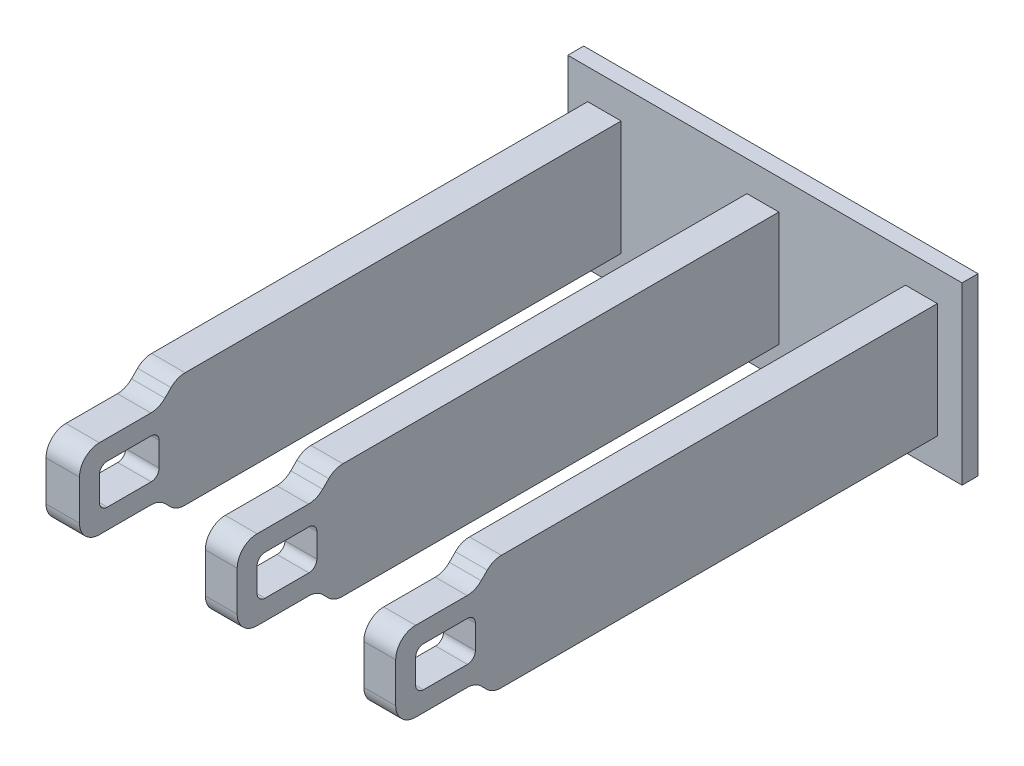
SolidWorks part; units mm, degrees
ref_plane "Plan de face" through (0, 0, 0) normal (0, 0, 1) x (1, 0, 0)
ref_plane "Plan de dessus" through (0, 0, 0) normal (0, 1, 0) x (1, 0, 0)
ref_plane "Plan de droite" through (0, 0, 0) normal (1, 0, 0) x (0, 0, -1)
sketch "Esquisse1" plane through (0, 0, 0) normal (0, 0, 1) x (1, 0, 0)
  line L1 (0, 0) -> (9.9, 0)
  line L2 (0, 0) -> (0, 4.4)
  line L3 (0, 4.4) -> (9.9, 4.4)
  line L4 (9.9, 0) -> (9.9, 4.4)
  dimension "D1" = 4.4
  dimension "D2" = 9.9
extrude "Boss.-Extru.1" add sketch "Esquisse1" along normal blind 14
sketch "Esquisse2" plane through (0, 0, 14) normal (0, 0, 1) x (1, 0, 0)
  line L0 (9.9, 4.4) -> (0, 4.4) construction
  line L1 (0, 0) -> (0.5, 0)
  line L2 (0, 0) -> (0, 4.4)
  line L3 (0, 4.4) -> (0.5, 4.4)
  line L4 (0.5, 0) -> (0.5, 4.4)
  line L5 (0, 0) -> (9.9, 0) construction
  line L6 (1.34, 4.4) -> (4.5, 4.4)
  line L7 (1.34, 4.4) -> (1.34, 0)
  line L8 (1.34, 0) -> (4.5, 0)
  line L9 (4.5, 4.4) -> (4.5, 0)
  line L11 (5.3, 4.4) -> (9.28, 4.4)
  line L12 (5.3, 4.4) -> (5.3, 0)
  line L13 (5.3, 0) -> (9.28, 0)
  line L14 (9.28, 4.4) -> (9.28, 0)
  line L15 (8.48, 4.4) -> (9.9, 4.4)
  line L16 (8.48, 4.4) -> (8.48, 0)
  line L17 (8.48, 0) -> (9.9, 0)
  line L18 (9.9, 4.4) -> (9.9, 0)
  dimension "D1" = 0.5
  dimension "D2" = 0.84
  dimension "D3" = 0.8
  dimension "D4" = 0.8
  dimension "D5" = 3.16
  dimension "D6" = 3.18
extrude "Enlèv. mat.-Extru.1" cut sketch "Esquisse2" against normal blind 13.6 contours L4 M2 M4 M1 | L9 L7 M4 M2 | L16 L11 L12 M2 | L14 M4 M2 M3
sketch "Esquisse3" plane through (0, 0, 14) normal (0, 0, 1) x (1, 0, 0)
  line L0 (9.28, 4.4) -> (9.28, 0) construction
  line L1 (0.5, 4.4) -> (9.28, 4.4)
  line L2 (0.5, 4.4) -> (0.5, 3.64)
  line L3 (0.5, 3.64) -> (9.28, 3.64)
  line L4 (9.28, 4.4) -> (9.28, 3.64)
  line L5 (9.28, 4.4) -> (9.28, 0) construction
  line L6 (0.5, 0) -> (9.28, 0)
  line L7 (0.5, 0) -> (0.5, 0.76)
  line L8 (0.5, 0.76) -> (9.28, 0.76)
  line L9 (9.28, 0) -> (9.28, 0.76)
  line L10 (-0.9364, 2.2) -> (10.6828, 2.2) construction
  dimension "D1" = 2.2
  dimension "D2" = 1.44
  dimension "D3" = 1.44
extrude "Enlèv. mat.-Extru.2" cut sketch "Esquisse3" against normal blind 13.6
sketch "Esquisse4" plane through (9.28, 0, 0) normal (1, 0, 0) x (0, 0, -1)
  line L0 (-14.8391, 2.1944) -> (-9.2499, 2.1944) construction
  line L1 (-0.4, 3.64) -> (-14, 3.64) construction
  line L2 (-11.5656, 0.76) -> (-14, 0.76)
  line L3 (-14, 3.64) -> (-14, 0.76) construction
  line L4 (-13.5, 2.6944) -> (-12, 2.6944)
  line L5 (-13.5, 2.6944) -> (-13.5, 1.6944)
  line L6 (-13.5, 1.6944) -> (-12, 1.6944)
  line L7 (-12, 2.6944) -> (-12, 1.6944)
  line L8 (-14, 3.1944) -> (-12, 3.1944)
  line L9 (-12, 3.1944) -> (-11.5544, 3.64)
  line L10 (-11.5544, 3.64) -> (-14, 3.64)
  line L11 (-14, 3.64) -> (-14, 3.1944)
  line L13 (-14, 0.76) -> (-14, 1.1944)
  line L14 (-14, 1.1944) -> (-12, 1.1944)
  line L15 (-12, 1.1944) -> (-11.5656, 0.76)
  line L16 (-0.4, 0.76) -> (-14, 0.76) construction
  dimension "D1" = 1.4456
  dimension "D2" = 0.5
  dimension "D3" = 1.5
  dimension "D4" = 0.5
  dimension "D5" = 0.5
  dimension "D6" = 1
  dimension "D7" = 0.5
  dimension "D8" = 2
  dimension "D9" = 2
  dimension "D10" = 135
  dimension "D11" = 135
extrude "Enlèv. mat.-Extru.3" cut sketch "Esquisse4" against normal blind 13.6
fillet "Congé1" radius 0.5 6 edges at (0.92, 0.76, 11.5656) (0.92, 1.1944, 12) (0.92, 1.1944, 14) (0.92, 3.1944, 14) (0.92, 3.1944, 12) (0.92, 3.64, 11.5544)
fillet "Congé2" radius 0.5 6 edges at (4.9, 0.76, 11.5656) (4.9, 1.1944, 12) (4.9, 1.1944, 14) (4.9, 3.1944, 14) (4.9, 3.1944, 12) (4.9, 3.64, 11.5544)
fillet "Congé3" radius 0.5 6 edges at (8.88, 0.76, 11.5656) (8.88, 1.1944, 12) (8.88, 1.1944, 14) (8.88, 3.1944, 14) (8.88, 3.1944, 12) (8.88, 3.64, 11.5544)
fillet "Congé4" radius 0.2 12 edges at (0.92, 1.6944, 13.5) (4.9, 1.6944, 13.5) (0.92, 2.6944, 13.5) (4.9, 2.6944, 13.5) (0.92, 1.6944, 12) (0.92, 2.6944, 12) (4.9, 2.6944, 12) (4.9, 1.6944, 12) (8.88, 1.6944, 12) (8.88, 2.6944, 12) (8.88, 2.6944, 13.5) (8.88, 1.6944, 13.5)
